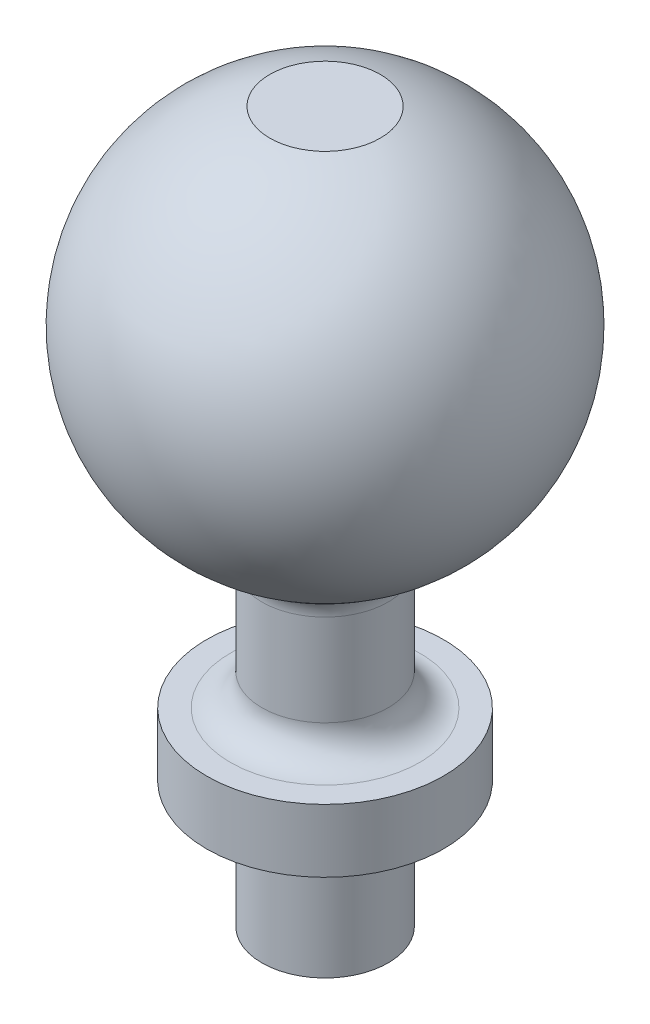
SolidWorks part; units mm, degrees
ref_plane "Front" through (0, 0, 0) normal (0, 0, 1) x (1, 0, 0)
ref_plane "Top" through (0, 0, 0) normal (0, 1, 0) x (1, 0, 0)
ref_plane "Right" through (0, 0, 0) normal (1, 0, 0) x (0, 0, -1)
sketch "Sketch1" plane through (0, 0, 0) normal (0, 0, 1) x (1, 0, 0)
  line L0 (0, 0) -> (0, -46.7246) construction
  line L1 (0, 45) -> (0, 0)
  line L2 (6, 12) -> (7.5, 12)
  line L3 (4, 14) -> (4, 19.7996)
  line L4 (0, 45) -> (3.5, 45)
  line L5 (7.5, 12) -> (7.5, 8)
  line L6 (7.5, 8) -> (4, 8)
  line L7 (4, 8) -> (4, 0)
  line L8 (4, 0) -> (0, 0)
  arc A0 (5.1724, 21.6204) -> (3.5, 45) centre (0, 33) ccw
  arc A1 (4, 14) -> (6, 12) centre (6, 14) ccw
  arc A3 (5.1724, 21.6204) -> (4, 19.7996) centre (6, 19.7996) ccw
  dimension "D1" = 25
  dimension "D2" = 15
  dimension "D5" = 33
  dimension "D8" = 2
  dimension "D3" = 8
  dimension "D4" = 45
  dimension "D6" = 8
  dimension "D7" = 12
revolve "Base-Revolve" add sketch "Sketch1" angle 360 about L0
